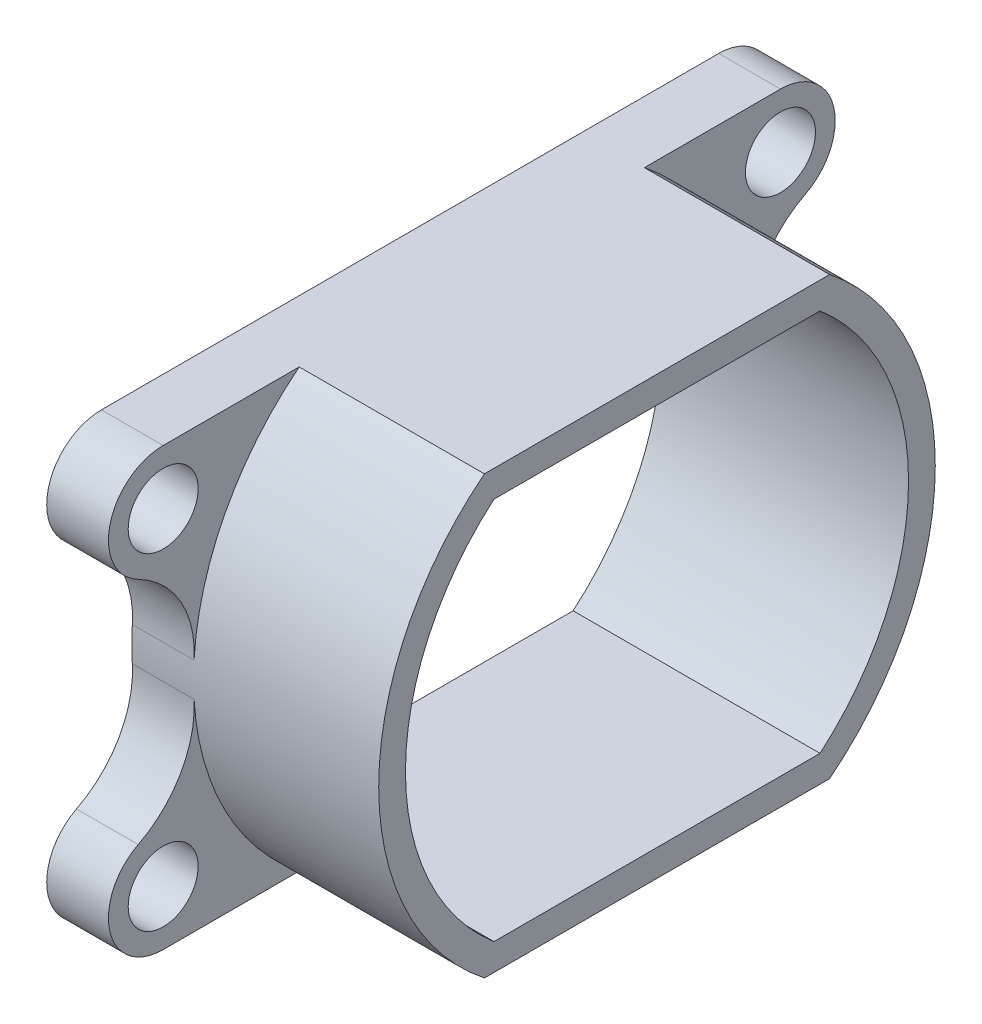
SolidWorks part; units mm, degrees
ref_plane "Front Plane" through (0, 0, 0) normal (0, 0, 1) x (1, 0, 0)
ref_plane "Top Plane" through (0, 0, 0) normal (0, 1, 0) x (1, 0, 0)
ref_plane "Right Plane" through (0, 0, 0) normal (1, 0, 0) x (0, 0, -1)
sketch "Sketch1" plane through (0, 0, 0) normal (1, 0, 0) x (0, 0, -1)
  line L0 (-7.8677, -9.16) -> (7.8677, -9.16) construction
  line L1 (-7.8677, 9.16) -> (7.8677, 9.16) construction
  line L2 (-7.8677, -9.16) -> (7.8677, 9.16) construction
  line L3 (-7.8677, 9.16) -> (7.8677, -9.16) construction
  line L4 (-7.923, 9.31) -> (7.923, 9.31)
  line L5 (-7.923, -9.31) -> (7.923, -9.31)
  line L6 (-8.3877, 10.61) -> (8.3877, 10.61)
  line L7 (-8.3877, -10.61) -> (8.3877, -10.61)
  arc A0 (-7.8677, 9.16) -> (-7.8677, -9.16) centre (0, 0) ccw construction
  arc A1 (7.8677, -9.16) -> (7.8677, 9.16) centre (0, 0) ccw construction
  arc A2 (7.923, -9.31) -> (7.923, 9.31) centre (0, 0) ccw
  arc A3 (-7.923, 9.31) -> (-7.923, -9.31) centre (0, 0) ccw
  arc A4 (8.3877, -10.61) -> (8.3877, 10.61) centre (0, 0) ccw
  arc A5 (-8.3877, 10.61) -> (-8.3877, -10.61) centre (0, 0) ccw
  point P0 (0, 0)
  dimension "D2" = 24.15
  dimension "D1" = 18.32
  dimension "D3" = 0.15
  dimension "D4" = 1.3
extrude "Motor Holder" add sketch "Sketch1" along normal blind 12
sketch "Sketch2" plane through (0, 0, 0) normal (-1, 0, 0) x (0, 0, 1)
  line L4 (0, 0) -> (0, 27.8421) construction
  line L5 (0, 0) -> (-9.5877, 0) construction
  line L7 (8.3877, 10.61) -> (15, 10.61)
  line L24 (15.862, 5.4335) -> (12.7951, 4.383)
  line L25 (15.862, -5.4335) -> (12.7951, -4.383)
  line L26 (8.3877, -10.61) -> (15, -10.61)
  line L27 (-8.3877, -10.61) -> (-15, -10.61)
  line L28 (-15.862, -5.4335) -> (-12.7951, -4.383)
  line L29 (-15.862, 5.4335) -> (-12.7951, 4.383)
  line L30 (-8.3877, 10.61) -> (-15, 10.61)
  circle A10 centre (15, 7.95) radius 1.7
  circle A12 centre (-15, 7.95) radius 1.7
  circle A13 centre (15, -7.95) radius 1.7
  circle A14 centre (-15, -7.95) radius 1.7
  arc A16 (-8.3877, 10.61) -> (-8.3877, -10.61) centre (0, 0) ccw construction
  arc A20 (15, 10.61) -> (15.862, 5.4335) centre (15, 7.95) cw
  arc A21 (8.3877, 10.61) -> (12.7951, 4.383) centre (0, 0) cw
  arc A22 (-8.3877, 10.61) -> (-8.3877, -10.61) centre (0, 0) ccw
  arc A31 (-8.3877, 10.61) -> (-8.3877, -10.61) centre (0, 0) ccw
  arc A32 (8.3877, -10.61) -> (8.3877, 10.61) centre (0, 0) ccw construction
  arc A33 (15, -10.61) -> (15.862, -5.4335) centre (15, -7.95) ccw
  arc A34 (8.3877, -10.61) -> (12.7951, -4.383) centre (0, 0) ccw
  arc A35 (-8.3877, -10.61) -> (-12.7951, -4.383) centre (0, 0) cw
  arc A36 (-15, -10.61) -> (-15.862, -5.4335) centre (-15, -7.95) cw
  arc A37 (-15, 10.61) -> (-15.862, 5.4335) centre (-15, 7.95) ccw
  arc A38 (-8.3877, 10.61) -> (-12.7951, 4.383) centre (0, 0) ccw
  dimension "D2" = 3.4
  dimension "D1" = 7.95
  dimension "D3" = 15
extrude "Boss-Extrude1" add sketch "Sketch2" against normal blind 3 contours L30 A37 L29 A12 M13 | A36 L27 L28 A14 M13 | L26 A33 L25 A13 M11 | A20 L7 L24 A10 M11
fillet "Fillet1" radius 5 4 edges at (1.5, -4.383, -12.7951) (1.5, 4.383, -12.7951) (1.5, -4.383, 12.7951) (1.5, 4.383, 12.7951)
